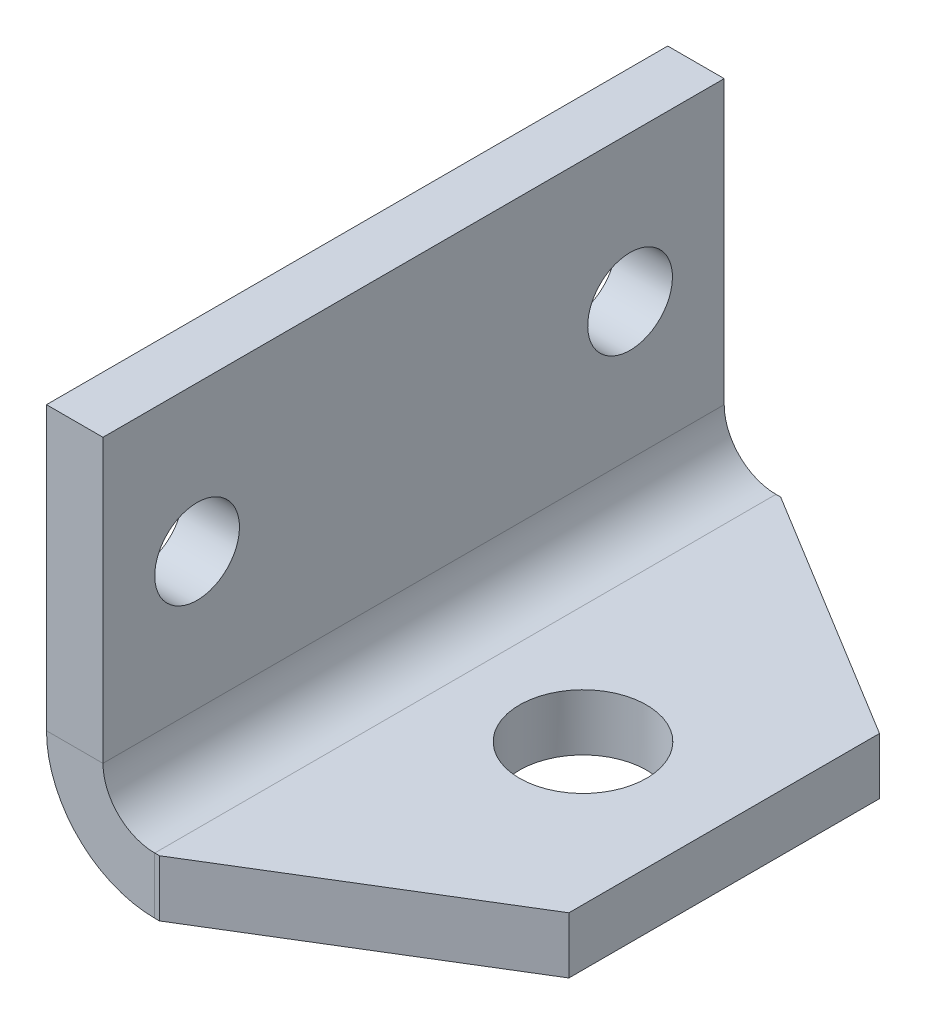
SolidWorks part; units mm, degrees
ref_plane "face" through (0, 0, 0) normal (0, 0, 1) x (1, 0, 0)
ref_plane "dessus" through (0, 0, 0) normal (0, 1, 0) x (1, 0, 0)
ref_plane "profil" through (0, 0, 0) normal (1, 0, 0) x (0, 0, -1)
sketch "Esquisse1" plane through (0, 0, 0) normal (0, 0, 1) x (1, 0, 0)
  line L0 (0, 0) -> (78, 0)
  line L1 (0, 0) -> (0, 83)
  line L2 (0, 83) -> (12, 83)
  line L3 (12, 83) -> (12, 12)
  line L4 (12, 12) -> (78, 12)
  line L5 (78, 12) -> (78, 0)
  dimension "D1" = 78
  dimension "D2" = 83
  dimension "D3" = 12
  dimension "D4" = 12
extrude "Base-Extrusion" add sketch "Esquisse1" against normal blind 132
fillet "Congé1" radius 11
fillet "Congé2" radius 23
sketch "Esquisse2" plane through (0, 12, 0) normal (0, 1, 0) x (-1, 0, 0)
  line L0 (-78, -33) -> (-24, 0)
  line L1 (-78, -132) -> (-78, 0) construction
  line L2 (-78, 0) -> (-23, 0) construction
  line L3 (-78, -33) -> (-78, 0)
  dimension "D1" = 33
  dimension "D2" = 54
extrude "Enlèv. mat.-Extru.3" cut sketch "Esquisse2" against normal through all and the other way through all flip side to cut
sketch "Esquisse4" plane through (0, 12, 0) normal (0, 1, 0) x (-1, 0, 0)
  line L0 (-78, -99) -> (-24, -132)
  line L1 (-78, -99) -> (-78, -132)
  line L2 (-78, -132) -> (-78, -33) construction
  line L3 (-78, -132) -> (-23, -132) construction
  line L4 (-78, -132) -> (-24, -132)
  dimension "D1" = 33
  dimension "D2" = 54
extrude "Enlèv. mat.-Extru.4" cut sketch "Esquisse4" against normal blind 132
sketch "Esquisse5" plane through (0, 12, 0) normal (0, 1, 0) x (-1, 0, 0)
  line L0 (-24, 0) -> (-23, 0) construction
  line L1 (-78, -99) -> (-78, -33) construction
  circle A0 centre (-48, -66) radius 13.5
  dimension "D1" = 66
  dimension "D3" = 27
  dimension "D2" = 30
extrude "Enlèv. mat.-Extru.5" cut sketch "Esquisse5" against normal blind 132
sketch "Esquisse6" plane through (12, 0, 0) normal (1, 0, 0) x (0, 0, -1)
  line L0 (0, 23) -> (0, 83) construction
  line L1 (132, 83) -> (0, 83) construction
  circle A0 centre (20, 52) radius 9
  dimension "D3" = 18
  dimension "D1" = 20
  dimension "D2" = 31
extrude "Enlèv. mat.-Extru.6" cut sketch "Esquisse6" against normal blind 132
sketch "Esquisse7" plane through (12, 0, 0) normal (1, 0, 0) x (0, 0, -1)
  line L0 (132, 23) -> (132, 83) construction
  line L2 (132, 83) -> (0, 83) construction
  circle A1 centre (112, 52) radius 9
  dimension "D2" = 20
  dimension "D1" = 18
  dimension "D3" = 31
extrude "Enlèv. mat.-Extru.7" cut sketch "Esquisse7" against normal blind 132
sheet metal parameters "Tôlerie 1" parameters "D1"=11, "Epaisseur"=12
bend "Pli issu d'un arrondi1" bend radius 11
flatten bends "Dépliage 1" parameters "D1"=0, "D4"=90, "D5"=1
sketch "Esquisse-Angle1" plane through (12, 0, 0) normal (1, 0, 0) x (0, 0, -1)
  line L0 (0, 9.6482) -> (132, 9.6482) construction
process bends "Pliage 1" parameters "D1"=0
sketch "Esquisse-Plate1" plane through (12, 0, 0) normal (1, 0, 0) x (0, 0, -1)
